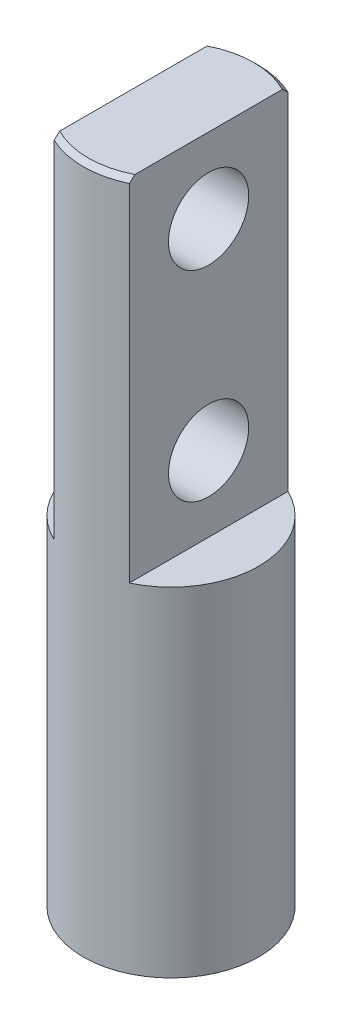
SolidWorks part; units mm, degrees
ref_plane "Front Plane" through (0, 0, 0) normal (0, 0, 1) x (1, 0, 0)
ref_plane "Top Plane" through (0, 0, 0) normal (0, 1, 0) x (1, 0, 0)
ref_plane "Right Plane" through (0, 0, 0) normal (1, 0, 0) x (0, 0, -1)
sketch "Sketch1" plane through (0, 0, 0) normal (0, 1, 0) x (1, 0, 0)
  circle A0 centre (0, 0) radius 3.5
  dimension "D1" = 7
extrude "Boss-Extrude1" add sketch "Sketch1" against normal blind 13.5
sketch "Sketch2" plane through (0, 0, 0) normal (0, 1, 0) x (1, 0, 0)
  line L0 (0, -3.5) -> (0, 3.5) construction
  line L1 (1.5, -3.1623) -> (1.5, 3.1623)
  line L2 (-1.5, -3.1623) -> (-1.5, 3.1623)
  line L3 (-1.5, -3.5) -> (-1.5, 3.5) construction
  line L4 (1.5, -3.5) -> (1.5, 3.5) construction
  arc A0 (-1.5, -3.1623) -> (1.5, -3.1623) centre (0, 0) ccw
  arc A1 (1.5, 3.1623) -> (-1.5, 3.1623) centre (0, 0) ccw
  dimension "D1" = 7
  dimension "D2" = 1.5
  dimension "D3" = 1.5
extrude "Boss-Extrude2" add sketch "Sketch2" along normal blind 14
sketch "Sketch3" plane through (1.5, 0, 0) normal (1, 0, 0) x (0, 0, -1)
  line L2 (-3.1623, 14) -> (3.1623, 14) construction
  circle A0 centre (0, 11) radius 1.6
  circle A1 centre (0, 3) radius 1.6
  dimension "D1" = 3.2
  dimension "D2" = 3
  dimension "D3" = 8
extrude "Cut-Extrude1" cut sketch "Sketch3" against normal up to surface (3 mm away)
chamfer "Chamfer1" distance 0.2 angle 45 2 edges at (0, 14, 3.5) (0, 14, -3.5)
